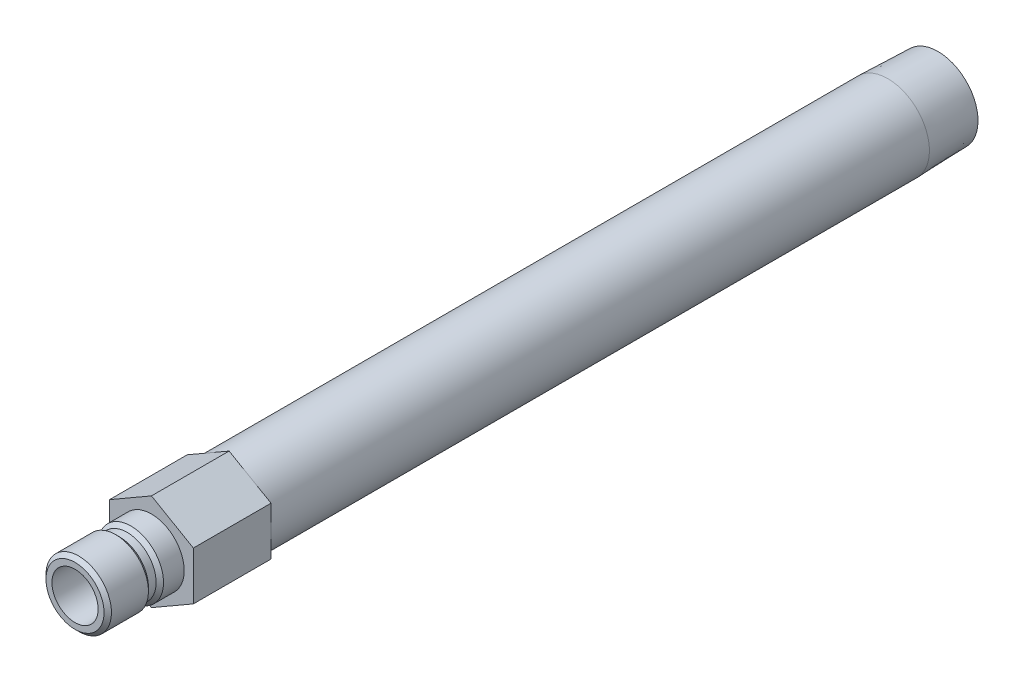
SolidWorks part; units mm, degrees
ref_plane "Front Plane" through (0, 0, 0) normal (0, 0, 1) x (1, 0, 0)
ref_plane "Top Plane" through (0, 0, 0) normal (0, 1, 0) x (1, 0, 0)
ref_plane "Right Plane" through (0, 0, 0) normal (1, 0, 0) x (0, 0, -1)
sketch "Sketch1" plane through (0, 0, 0) normal (1, 0, 0) x (0, 0, -1)
  line L0 (0, 0) -> (-18.923, 0) construction
  line L1 (-15.748, 4.7625) -> (-15.748, 5.9817)
  line L2 (-6.604, 5.9817) -> (-6.604, 0) construction
  line L3 (-14.986, 6.7437) -> (-7.366, 6.7437)
  line L4 (0, 8.5725) -> (0, 0) construction
  line L5 (-6.604, 5.9817) -> (-5.0165, 5.9817)
  line L6 (-4.2545, 6.7437) -> (0, 6.7437)
  line L7 (0, 6.7437) -> (0, 8.5725)
  line L8 (-6.604, 5.9817) -> (-7.366, 6.7437)
  line L9 (-5.0165, 5.9817) -> (-4.2545, 6.7437)
  line L10 (-15.748, 5.9817) -> (-14.986, 6.7437)
  line L11 (-15.748, 4.7625) -> (16.002, 4.7625)
  line L12 (0, 8.5725) -> (151.7142, 8.5725)
  line L13 (151.7142, 8.5725) -> (162.052, 8.2494)
  line L14 (162.052, 8.2494) -> (162.052, 6.2611)
  line L15 (0, 6.7437) -> (16.002, 6.7437) construction
  line L16 (16.002, 6.7437) -> (16.002, 0) construction
  line L17 (16.002, 0) -> (0, 0) construction
  line L18 (16.002, 4.7625) -> (16.002, 6.2611)
  line L19 (16.002, 6.2611) -> (162.052, 6.2611)
  dimension "D1" = 15.748
  dimension "D2" = 1.5875
  dimension "D3" = 0.762
  dimension "D4" = 45
  dimension "D5" = 9.144
  dimension "D6" = 45
  dimension "D7" = 1.79
  dimension "D8" = 10.3378
  dimension "D9" = 177.8
  dimension "D10" = 3.175
  dimension "D11" = 9.525
  dimension "D12" = 17.145
  dimension "D13" = 31.75
  dimension "D14" = 13.4874
  dimension "D15" = 12.5222
revolve "Revolve1" add sketch "Sketch1" angle 360 about L0
sketch "Sketch2" plane through (0, 0, 0) normal (0, 0, 1) x (1, 0, 0)
  line L1 (-8.636, 4.986) -> (-8.636, -4.986)
  line L2 (-8.636, -4.986) -> (0, -9.972)
  line L3 (0, -9.972) -> (8.636, -4.986)
  line L4 (8.636, -4.986) -> (8.636, 4.986)
  line L5 (8.636, 4.986) -> (0, 9.972)
  line L6 (0, 9.972) -> (-8.636, 4.986)
  circle A0 centre (0, 0) radius 8.636 construction
  circle A1 centre (0, 0) radius 4.7625 construction
  circle A2 centre (0, 0) radius 4.7625
  dimension "D1" = 17.272
extrude "Boss-Extrude1" add sketch "Sketch2" against normal up to vertex (16.002 mm away) from vertex at 0
